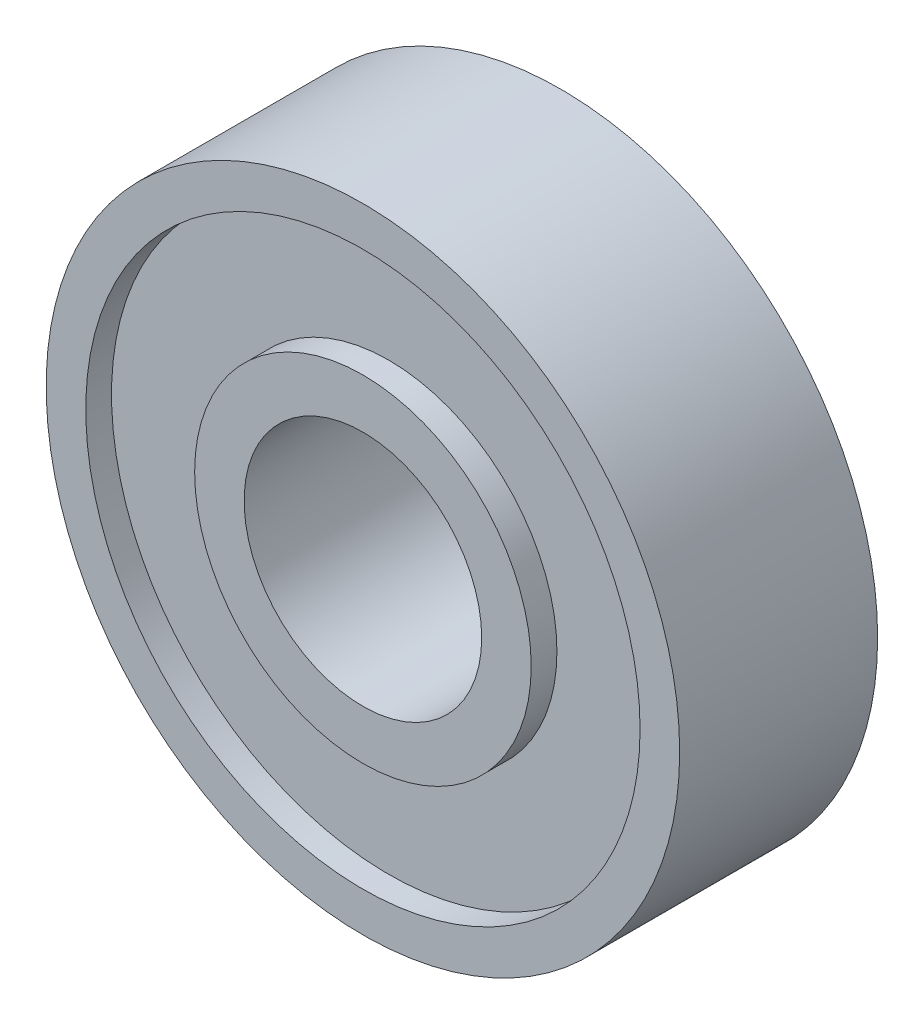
SolidWorks part; units mm, degrees
ref_plane "Alzado" through (0, 0, 0) normal (0, 0, 1) x (1, 0, 0)
ref_plane "Planta" through (0, 0, 0) normal (0, 1, 0) x (1, 0, 0)
ref_plane "Vista lateral" through (0, 0, 0) normal (1, 0, 0) x (0, 0, -1)
sketch "Croquis1" plane through (0, 0, 0) normal (0, 0, 1) x (1, 0, 0)
  circle A0 centre (0, 0) radius 16
  circle A1 centre (0, 0) radius 6
extrude "Extruir1" add sketch "Croquis1" along normal blind 10
sketch "Croquis2" plane through (0, 0, 10) normal (0, 0, 1) x (1, 0, 0)
  circle A0 centre (0, 0) radius 14
  circle A1 centre (0, 0) radius 8.5
extrude "Cortar-Extruir1" cut sketch "Croquis2" against normal blind 1.3
sketch "Croquis3" plane through (0, 0, 0) normal (0, 0, -1) x (-1, 0, 0)
  circle A0 centre (0, 0) radius 12.25
  circle A1 centre (0, 0) radius 8
extrude "Cortar-Extruir2" cut sketch "Croquis3" against normal blind 1.8
